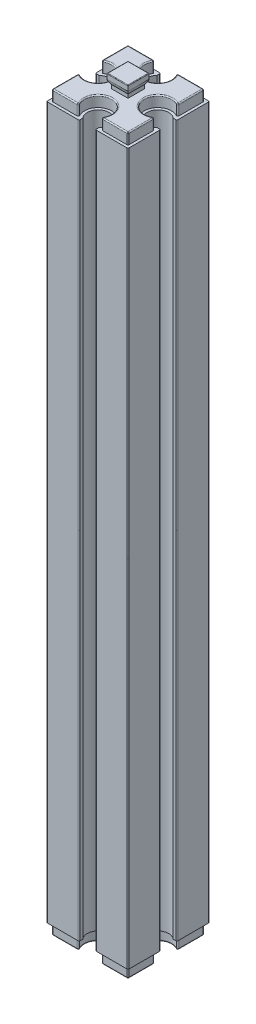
SolidWorks part; units mm, degrees
ref_plane "前视基准面" through (0, 0, 0) normal (0, 0, 1) x (1, 0, 0)
ref_plane "上视基准面" through (0, 0, 0) normal (0, 1, 0) x (1, 0, 0)
ref_plane "右视基准面" through (0, 0, 0) normal (1, 0, 0) x (0, 0, -1)
sketch "草图1" plane through (0, 0, 0) normal (0, 1, 0) x (1, 0, 0)
  line L0 (0, 0) -> (0, 7.5) construction
  line L1 (0, 0) -> (7.5, 0) construction
  line L2 (-7.5, 7.5) -> (-1.5, 7.5)
  line L3 (7.5, 7.5) -> (7.5, 1.5)
  line L4 (6.8229, 1.5) -> (7.5, 1.5)
  line L5 (6.8229, -1.5) -> (7.5, -1.5)
  line L6 (0, 7.5) -> (0, 5.5) construction
  line L7 (-1.5, 6.8229) -> (-1.5, 7.5)
  line L8 (1.5, 6.8229) -> (1.5, 7.5)
  line L9 (1.5, 7.5) -> (7.5, 7.5)
  line L10 (7.5, -1.5) -> (7.5, -7.5)
  line L11 (7.5, -7.5) -> (1.5, -7.5)
  line L12 (1.5, -6.8229) -> (1.5, -7.5)
  line L13 (-1.5, -6.8229) -> (-1.5, -7.5)
  line L14 (-1.5, -7.5) -> (-7.5, -7.5)
  line L15 (-7.5, -7.5) -> (-7.5, -1.5)
  line L16 (-6.8229, -1.5) -> (-7.5, -1.5)
  line L17 (-6.8229, 1.5) -> (-7.5, 1.5)
  line L18 (-7.5, 1.5) -> (-7.5, 7.5)
  arc A0 (-1.5, 6.8229) -> (1.5, 6.8229) centre (0, 5.5) ccw
  arc A1 (6.8229, 1.5) -> (6.8229, -1.5) centre (5.5, 0) ccw
  arc A2 (1.5, -6.8229) -> (-1.5, -6.8229) centre (0, -5.5) ccw
  arc A3 (-6.8229, -1.5) -> (-6.8229, 1.5) centre (-5.5, 0) ccw
  point P36 (0, 0)
  dimension "D6" = 4
  dimension "D7" = 2
  dimension "D1" = 7.5
  dimension "D2" = 7.5
  dimension "D3" = 2
  dimension "D4" = 7.5
  dimension "D5" = 1.5
extrude "凸台-拉伸1" add sketch "草图1" along normal blind 65.5
sketch "草图2" plane through (0, 65.5, 0) normal (0, 1, 0) x (1, 0, 0)
  line L0 (-7, 7) -> (-7, 2)
  line L1 (-7, 2) -> (-7, 2)
  line L2 (-7, -2) -> (-7, -2)
  line L3 (-7, -2) -> (-7, -7)
  line L4 (-7, -7) -> (-2, -7)
  line L5 (-2, -7) -> (-2, -7)
  line L6 (2, -7) -> (2, -7)
  line L7 (2, -7) -> (7, -7)
  line L8 (7, -7) -> (7, -2)
  line L9 (7, -2) -> (7, -2)
  line L10 (7, 2) -> (7, 2)
  line L11 (7, 2) -> (7, 7)
  line L12 (7, 7) -> (2, 7)
  line L13 (2, 7) -> (2, 7)
  line L14 (-2, 7) -> (-2, 7)
  line L15 (-2, 7) -> (-7, 7)
  line L16 (-7.5, 7.5) -> (-7.5, 1.5)
  line L17 (-7.5, 1.5) -> (-6.8229, 1.5)
  line L18 (-6.8229, -1.5) -> (-7.5, -1.5)
  line L19 (-7.5, -1.5) -> (-7.5, -7.5)
  line L20 (-7.5, -7.5) -> (-1.5, -7.5)
  line L21 (-1.5, -7.5) -> (-1.5, -6.8229)
  line L22 (1.5, -6.8229) -> (1.5, -7.5)
  line L23 (1.5, -7.5) -> (7.5, -7.5)
  line L24 (7.5, -7.5) -> (7.5, -1.5)
  line L25 (7.5, -1.5) -> (6.8229, -1.5)
  line L26 (6.8229, 1.5) -> (7.5, 1.5)
  line L27 (7.5, 1.5) -> (7.5, 7.5)
  line L28 (7.5, 7.5) -> (1.5, 7.5)
  line L29 (1.5, 7.5) -> (1.5, 6.8229)
  line L30 (-1.5, 6.8229) -> (-1.5, 7.5)
  line L31 (-1.5, 7.5) -> (-7.5, 7.5)
  line L32 (-7.5, 7.5) -> (-7.5, 1.5) construction
  line L33 (-7.5, 1.5) -> (-6.8229, 1.5) construction
  line L34 (-6.8229, -1.5) -> (-7.5, -1.5) construction
  line L35 (-7.5, -1.5) -> (-7.5, -7.5) construction
  line L36 (-7.5, -7.5) -> (-1.5, -7.5) construction
  line L37 (-1.5, -7.5) -> (-1.5, -6.8229) construction
  line L38 (1.5, -6.8229) -> (1.5, -7.5) construction
  line L39 (1.5, -7.5) -> (7.5, -7.5) construction
  line L40 (7.5, -7.5) -> (7.5, -1.5) construction
  line L41 (7.5, -1.5) -> (6.8229, -1.5) construction
  line L42 (6.8229, 1.5) -> (7.5, 1.5) construction
  line L43 (7.5, 1.5) -> (7.5, 7.5) construction
  line L44 (7.5, 7.5) -> (1.5, 7.5) construction
  line L45 (1.5, 7.5) -> (1.5, 6.8229) construction
  line L46 (-1.5, 6.8229) -> (-1.5, 7.5) construction
  line L47 (-1.5, 7.5) -> (-7.5, 7.5) construction
  arc A0 (-7, -2) -> (-7, 2) centre (-5.5, 0) ccw
  arc A1 (2, -7) -> (-2, -7) centre (0, -5.5) ccw
  arc A2 (7, 2) -> (7, -2) centre (5.5, 0) ccw
  arc A3 (-2, 7) -> (2, 7) centre (0, 5.5) ccw
  arc A4 (-6.8229, -1.5) -> (-6.8229, 1.5) centre (-5.5, 0) ccw
  arc A5 (1.5, -6.8229) -> (-1.5, -6.8229) centre (0, -5.5) ccw
  arc A6 (6.8229, 1.5) -> (6.8229, -1.5) centre (5.5, 0) ccw
  arc A7 (-1.5, 6.8229) -> (1.5, 6.8229) centre (0, 5.5) ccw
  arc A8 (-6.8229, -1.5) -> (-6.8229, 1.5) centre (-5.5, 0) ccw construction
  arc A9 (1.5, -6.8229) -> (-1.5, -6.8229) centre (0, -5.5) ccw construction
  arc A10 (6.8229, 1.5) -> (6.8229, -1.5) centre (5.5, 0) ccw construction
  arc A11 (-1.5, 6.8229) -> (1.5, 6.8229) centre (0, 5.5) ccw construction
  dimension "D1" = 0
  dimension "D2" = 0.5
extrude "凸台-拉伸2" add sketch "草图2" along normal blind 2
sketch "草图3" plane through (0, 0, 0) normal (1, 0, 0) x (0, 0, -1)
  line L0 (0, 67.5) -> (0, 69.5) construction
  line L1 (2.5, 67.5) -> (-2.5, 67.5) construction
  line L2 (0, 69.5) -> (0, 70) construction
  line L3 (-1.5, 67.5) -> (1.5, 67.5)
  line L4 (1.5, 67.5) -> (1.5, 68.1771)
  line L5 (-1.95, 70) -> (1.95, 70)
  line L6 (1.95, 70) -> (1.95, 69.0556)
  line L7 (-1.5, 67.5) -> (-1.5, 68.1771)
  line L8 (-1.95, 70) -> (-1.95, 69.0556)
  arc A0 (-1.5, 68.1771) -> (-1.95, 69.0556) centre (0, 69.5) cw
  arc A1 (1.5, 68.1771) -> (1.95, 69.0556) centre (0, 69.5) ccw
  dimension "D5" = 2
  dimension "D1" = 2
  dimension "D2" = 0.5
  dimension "D3" = 1.5
  dimension "D4" = 1.95
extrude "凸台-拉伸3" add sketch "草图3" along normal blind 2 and the other way blind 2
sketch "草图4" plane through (0, 0, 0) normal (0, 0, 1) x (1, 0, 0)
  line L0 (0, 67.5) -> (0, 69.5) construction
  line L2 (-2, 67.5) -> (2, 67.5) construction
  line L3 (0, 69.5) -> (0, 70) construction
  line L4 (-2, 70) -> (2, 70) construction
  line L5 (1.95, 70) -> (2, 70)
  line L6 (-1.95, 70) -> (-1.95, 69.0556)
  line L9 (-1.5, 67.5) -> (-1.5, 68.1771)
  line L10 (1.5, 67.5) -> (1.5, 68.1771)
  line L11 (1.95, 70) -> (1.95, 69.0556)
  line L12 (1.5, 67.5) -> (2, 67.5)
  line L13 (-2, 70) -> (-1.95, 70)
  line L14 (-2, 70) -> (-2, 67.5)
  line L15 (-2, 67.5) -> (-1.5, 67.5)
  line L16 (2, 70) -> (2, 67.5)
  arc A0 (-1.95, 69.0556) -> (-1.5, 68.1771) centre (0, 69.5) ccw
  arc A1 (1.95, 69.0556) -> (1.5, 68.1771) centre (0, 69.5) cw
  dimension "D1" = 2
  dimension "D2" = 1.5
  dimension "D3" = 1.95
fillet "圆角3" radius 0.2 13 edges at (-1.5, 32.75, -7.5) (1.5, 32.75, -7.5) (7.5, 32.75, -7.5) (7.5, 32.75, -1.5) (7.5, 32.75, 1.5) (7.5, 32.75, 7.5) (-1.5, 32.75, 7.5) (1.5, 32.75, 7.5) (-6.8229, 32.75, -1.5) (-7.5, 32.75, 7.5) (-7.5, 32.75, 1.5) (-7.5, 32.75, -1.5) (-7.5, 32.75, -7.5)
extrude "切除-拉伸1" cut sketch "草图4" against normal blind 3 and the other way blind 3
fillet "圆角4" radius 0.2 24 edges at (0, 67.5, 3) (-3, 67.5, 0) (0, 67.5, -3) (3, 67.5, 0) (7, 66.5, 2) (7, 66.5, -2) (2, 66.5, -7) (-2, 66.5, -7) (-7, 66.5, 2) (-7, 66.5, -2) (2, 66.5, 7) (-2, 66.5, 7) (7, 66.5, 7) (4.5, 67.5, 7) (7, 67.5, 4.5) (7, 67.5, -4.5) (7, 66.5, -7) (4.5, 67.5, -7) (-4.5, 67.5, -7) (-7, 66.5, -7) (-7, 67.5, -4.5) (-4.5, 67.5, 7) (-7, 67.5, 4.5) (-7, 66.5, 7)
fillet "圆角5" radius 0.1 4 edges at (0, 70, -1.95) (1.95, 70, 0) (0, 70, 1.95) (-1.95, 70, 0)
mirror "镜向1" of "圆角5", "圆角4", "切除-拉伸1", "圆角3", "凸台-拉伸3", "凸台-拉伸2", "凸台-拉伸1"
